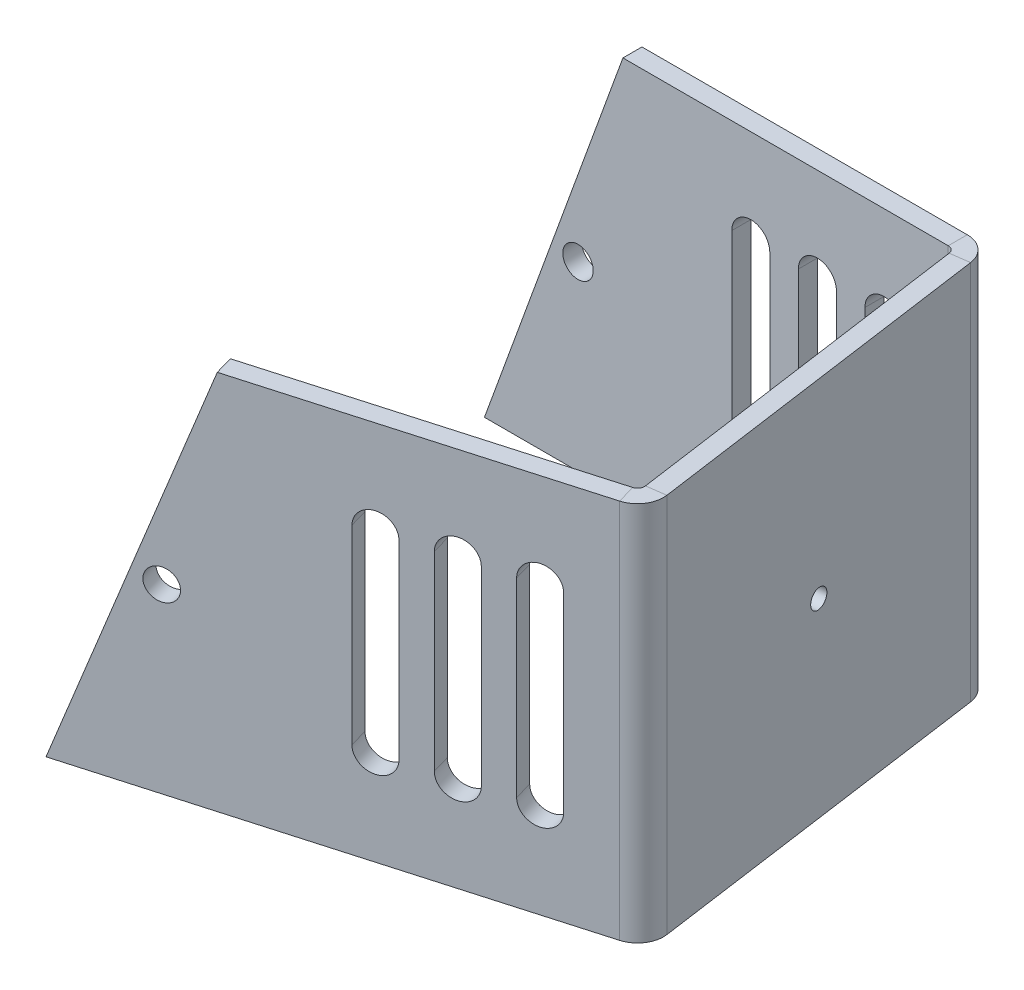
SolidWorks part; units mm, degrees
ref_plane "Plan de face" through (0, 0, 0) normal (0, 0, 1) x (1, 0, 0)
ref_plane "Plan de dessus" through (0, 0, 0) normal (0, 1, 0) x (1, 0, 0)
ref_plane "Plan de droite" through (0, 0, 0) normal (1, 0, 0) x (0, 0, -1)
sketch "Esquisse1" plane through (0, 0, 0) normal (0, 0, 1) x (1, 0, 0)
  line L0 (0, 0) -> (140, 0)
  line L1 (0, 0) -> (14.5589, 40.0002)
  line L2 (70, 15) -> (70, 25) construction
  line L3 (10.6723, 21.3658) -> (8.3584, 15.0086) construction
  line L4 (65, 20) -> (75, 20) construction
  line L5 (50, -5) -> (50, 45) construction
  line L6 (90, 45) -> (90, -5) construction
  line L7 (13.6024, 17.6987) -> (3.5273, 21.3658) construction
  line L8 (140, 0) -> (125.4411, 40.0002)
  line L11 (14.5589, 40.0002) -> (125.4411, 40.0002)
  circle A0 centre (9.8365, 19.0694) radius 1.6
  circle A1 centre (130.1635, 19.0694) radius 1.6
  circle A2 centre (70, 20) radius 1
extrude "Extrusion2" add sketch "Esquisse1" along normal blind 2
sketch "Esquisse2" plane through (0, 0, 2) normal (0, 0, 1) x (1, 0, 0)
  line L0 (50, 40.0002) -> (50, 0)
  line L1 (125.4411, 40.0002) -> (14.5589, 40.0002) construction
  line L2 (0, 0) -> (140, 0) construction
  line L3 (90, 40.0002) -> (90, 0)
sketch "Esquisse4" plane through (0, 0, 2) normal (0, 0, 1) x (1, 0, 0)
  line L0 (42, 35.8016) -> (42, 5.1646) construction
  line L1 (70, 16.757) -> (70, 53.7422) construction
  line L2 (5.4138, 30.0002) -> (63.7898, 30.0002) construction
  line L3 (125.4411, 40.0002) -> (14.5589, 40.0002) construction
  line L4 (-2.7284, 10) -> (67.9299, 10) construction
  line L5 (0, 0) -> (140, 0) construction
  line L6 (50, 50.7061) -> (50, -5.8758) construction
  line L7 (33, 30.0002) -> (33, 10)
  line L8 (40, 30.0002) -> (40, 10)
  line L9 (44, 30.0002) -> (44, 10)
  line L10 (37, 30.0002) -> (37, 10)
  line L11 (-9.7284, 10) -> (60.9299, 10) construction
  line L12 (-1.5862, 30.0002) -> (56.7898, 30.0002) construction
  line L13 (26, 30.0002) -> (26, 10)
  line L14 (30, 30.0002) -> (30, 10)
  line L15 (-16.7284, 10) -> (53.9299, 10) construction
  line L16 (-8.5862, 30.0002) -> (49.7898, 30.0002) construction
  line L17 (110, 30.0002) -> (110, 10)
  line L18 (114, 30.0002) -> (114, 10)
  line L19 (103, 30.0002) -> (103, 10)
  line L20 (96, 30.0002) -> (96, 10)
  line L21 (100, 30.0002) -> (100, 10)
  line L22 (107, 30.0002) -> (107, 10)
  arc A0 (40, 30.0002) -> (44, 30.0002) centre (42, 30.0002) cw
  arc A1 (44, 10) -> (40, 10) centre (42, 10) cw
  arc A2 (33, 30.0002) -> (37, 30.0002) centre (35, 30.0002) cw
  arc A3 (37, 10) -> (33, 10) centre (35, 10) cw
  arc A4 (26, 30.0002) -> (30, 30.0002) centre (28, 30.0002) cw
  arc A5 (30, 10) -> (26, 10) centre (28, 10) cw
  arc A6 (110, 10) -> (114, 10) centre (112, 10) ccw
  arc A7 (114, 30.0002) -> (110, 30.0002) centre (112, 30.0002) ccw
  arc A8 (103, 10) -> (107, 10) centre (105, 10) ccw
  arc A9 (107, 30.0002) -> (103, 30.0002) centre (105, 30.0002) ccw
  arc A10 (96, 10) -> (100, 10) centre (98, 10) ccw
  arc A11 (100, 30.0002) -> (96, 30.0002) centre (98, 30.0002) ccw
  dimension "D1" = 10
  dimension "D2" = 10
  dimension "D3" = 20
  dimension "D4" = 8
extrude "Enlèv. mat.-Extru.2" cut sketch "Esquisse4" against normal blind 10
sheet metal parameters "Tôlerie 1" parameters "D1"=0.7366
flatten bends "Dépliage 1" parameters "D1"=0
sketch "Esquisse-Angle1" plane through (0, 0, 2) normal (0, 0, 1) x (1, 0, 0)
process bends "Pliage 1" parameters "D1"=0.7366
sketch "Esquisse-Plate1" plane through (0, 0, 2) normal (0, 0, 1) x (1, 0, 0)
sketched bend "Pli esquissé1" parameters "D1"=0
bend "Pli esquissé2" bend radius 0.7366 bend angle 82 parameters "D5"=1
bend "Pli esquissé3" bend radius 0 bend angle 82 parameters "D5"=2
flat pattern "Etat déplié1"
sketch "Lignes de pliage1" plane through (0, 0, 2) normal (0, 0, 1) x (1, 0, 0)
  line L0 (90, 40.0002) -> (90, 0) construction
  line L1 (50, 40.0002) -> (50, 0) construction
bend of the flat pattern "Dépliage-<Pli esquissé2>1"
bend of the flat pattern "Dépliage-<Pli esquissé3>1"
